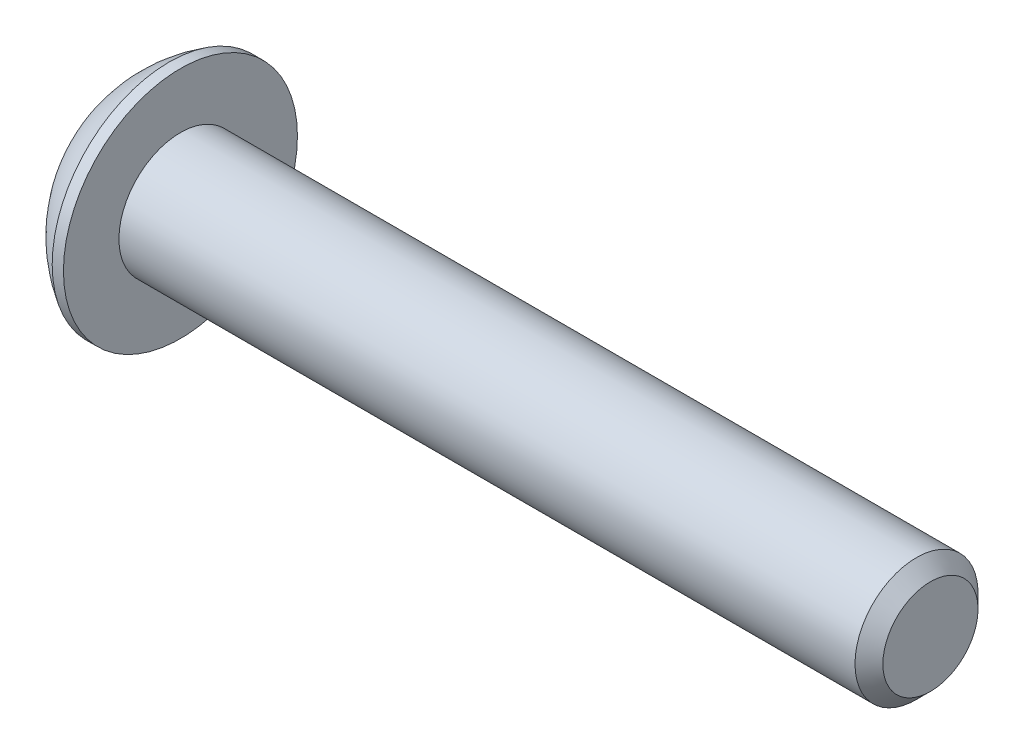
SolidWorks part; units mm, degrees
ref_plane "Plane1" through (0, 0, 0) normal (0, 0, 1) x (1, 0, 0)
ref_plane "Plane2" through (0, 0, 0) normal (0, 1, 0) x (1, 0, 0)
ref_plane "Plane3" through (0, 0, 0) normal (1, 0, 0) x (0, 0, -1)
sketch "BodySke" plane through (0, 0, 0) normal (0, 0, 1) x (1, 0, 0)
  line L0 (27.6098, 0) -> (27.6098, 1.6104)
  line L1 (27.1374, 2.0828) -> (2.2098, 2.0828)
  line L2 (2.2098, 2.0828) -> (2.2098, 3.9624)
  line L3 (2.2098, 3.9624) -> (1.8288, 3.9624)
  line L4 (0, 0) -> (101.6, 0) construction
  line L5 (2.2098, -3.9624) -> (1.8288, -3.9624) construction
  line L6 (55.6768, -2.0828) -> (2.2098, -2.0828) construction
  line L7 (27.6098, 0) -> (0, 0)
  line L8 (0, 1.9812) -> (0, -1.9812) construction
  line L9 (0, 0) -> (0, 1.9812)
  line L10 (27.6098, 1.6104) -> (27.1374, 2.0828)
  line L11 (27.6098, -1.6104) -> (27.1374, -2.0828) construction
  line L12 (3.0023, 9.525) -> (3.0023, -2.0828) construction
  line L13 (2.2098, 9.525) -> (2.2098, -2.0828) construction
  arc A1 (0, 1.9812) -> (1.8288, 3.9624) centre (4.1339, 0) cw
  dimension "D1" = 3.9624
  dimension "Diameter" = 4.1656
  dimension "Length" = 25.4
  dimension "Head_dia" = 7.9248
  dimension "Head_ht" = 2.2098
  dimension "Head_side_ht" = 0.381
  dimension "Minor_dia" = 3.2207
  dimension "Body_ch_ang" = 45
  dimension "Advance" = 0.7925
  dimension "Thread_nom" = 25.4
revolve "BaseBody" add sketch "BodySke" angle 360 about L4
sketch "Sketch2" plane through (0, 0, 0) normal (0, 0, 1) x (1, 0, 0)
  line L0 (0, 1.1938) -> (1.3208, 1.1938)
  line L1 (1.3208, 1.1938) -> (2.01, 0)
  line L3 (2.01, 0) -> (0, 0)
  line L4 (0, 0) -> (0, 1.1938)
  line L5 (0, -1.1938) -> (1.3208, -1.1938) construction
  line L6 (0, 0) -> (47.625, 0) construction
  dimension "D2" = 60
  dimension "PreBroach_depth" = 1.3208
  dimension "PreBroach_dia" = 2.3876
revolve "PreBroach" cut sketch "Sketch2" angle 360 about L6
sketch "Sketch3" plane through (0, 0, 0) normal (1, 0, 0) x (0, 0, -1)
  line L0 (-1.1938, -0.6892) -> (-1.1938, 0.6892)
  line L1 (-1.1938, 0.6892) -> (0, 1.3785)
  line L2 (0, 1.3785) -> (1.1938, 0.6892)
  line L3 (1.1938, 0.6892) -> (1.1938, -0.6892)
  line L4 (1.1938, -0.6892) -> (0, -1.3785)
  line L5 (0, -1.3785) -> (-1.1938, -0.6892)
  dimension "D1" = 1.1938
  dimension "D2" = 1.1938
  dimension "D3" = 2.3876
  dimension "Hex_size" = 2.3876
extrude "Hex" cut sketch "Sketch3" along normal blind 1.3208
equation "\"D1@BodySke\" = \"Head_dia@BodySke\" * .5"
equation "\"Thread_minor@ThreadCosmetic\" = \"Minor_dia@BodySke\""
equation "\"D1@Sketch3\" = \"Hex_size@Sketch3\" / 2"
equation "\"D2@Sketch3\" = \"D1@Sketch3\""
equation "\"D3@Sketch3\" = \"Hex_size@Sketch3\""
equation "\"Thread_length@ThreadCosmetic\" = ((sgn( (\"Length@BodySke\" - \"Advance@BodySke\" ) - \"Thread_nom@BodySke\" )-1)*( (\"Length@BodySke\" - \"Advance@BodySke\" ) - \"Thread_nom@BodySke\" ))/-2+ \"Thread_nom@BodySke\""
